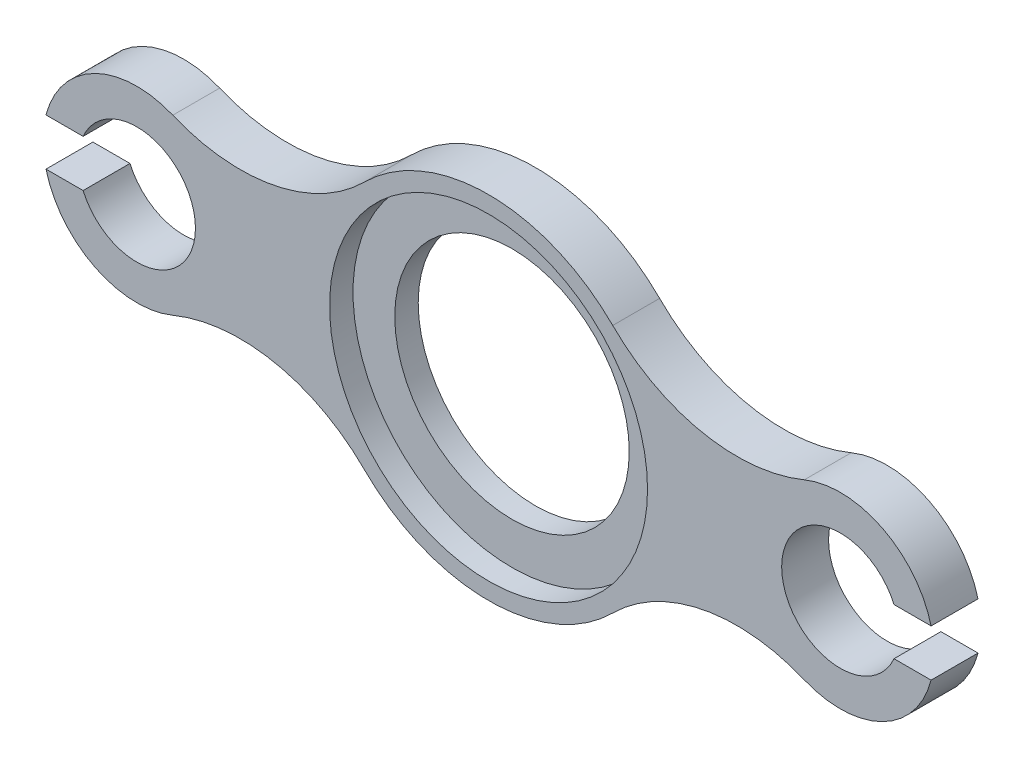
SolidWorks part; units mm, degrees
ref_plane "Front Plane" through (0, 0, 0) normal (0, 0, 1) x (1, 0, 0)
ref_plane "Top Plane" through (0, 0, 0) normal (0, 1, 0) x (1, 0, 0)
ref_plane "Right Plane" through (0, 0, 0) normal (1, 0, 0) x (0, 0, -1)
sketch "Esquisse1" plane through (0, 0, 0) normal (0, 0, 1) x (1, 0, 0)
  line L0 (0, 33.5619) -> (0, 0) construction
  line L1 (0, 0) -> (35.4299, 0) construction
  line L2 (172.9129, -10) -> (188.7298, -10)
  line L3 (-172.9129, 10) -> (-188.7298, 10)
  line L4 (-172.9129, -10) -> (-188.7298, -10)
  line L5 (172.9129, 10) -> (188.7298, 10)
  circle A0 centre (0, 0) radius 50
  arc A1 (-172.9129, -10) -> (-172.9129, 10) centre (-150, 0) ccw
  arc A2 (-188.7298, -10) -> (-134.6667, -36.9444) centre (-150, 0) ccw
  arc A3 (-52.9583, -53.1076) -> (52.9583, -53.1076) centre (0, 0) ccw
  arc A4 (-52.9583, 53.1076) -> (-134.6667, 36.9444) centre (-105.9167, 106.2152) cw
  arc A5 (-52.9583, -53.1076) -> (-134.6667, -36.9444) centre (-105.9167, -106.2152) ccw
  arc A6 (-134.6667, 36.9444) -> (-188.7298, 10) centre (-150, 0) ccw
  arc A7 (52.9583, -53.1076) -> (134.6667, -36.9444) centre (105.9167, -106.2152) cw
  arc A8 (188.7298, -10) -> (134.6667, -36.9444) centre (150, 0) cw
  arc A9 (172.9129, -10) -> (172.9129, 10) centre (150, 0) cw
  arc A10 (52.9583, 53.1076) -> (134.6667, 36.9444) centre (105.9167, 106.2152) ccw
  arc A11 (134.6667, 36.9444) -> (188.7298, 10) centre (150, 0) cw
  arc A12 (52.9583, 53.1076) -> (-52.9583, 53.1076) centre (0, 0) ccw
  dimension "D1" = 100
  dimension "D2" = 50
  dimension "D4" = 80
  dimension "D5" = 150
  dimension "D6" = 75
  dimension "D3" = 150
extrude "Boss.-Extru.1" add sketch "Esquisse1" along normal blind 20
sketch "Esquisse2" plane through (0, 0, 20) normal (0, 0, 1) x (1, 0, 0)
  circle A0 centre (0, 0) radius 67.8
  dimension "D1" = 135.6
extrude "Enlèv. mat.-Extru.1" cut sketch "Esquisse2" against normal blind 10
equation "\"A\"= 125"
